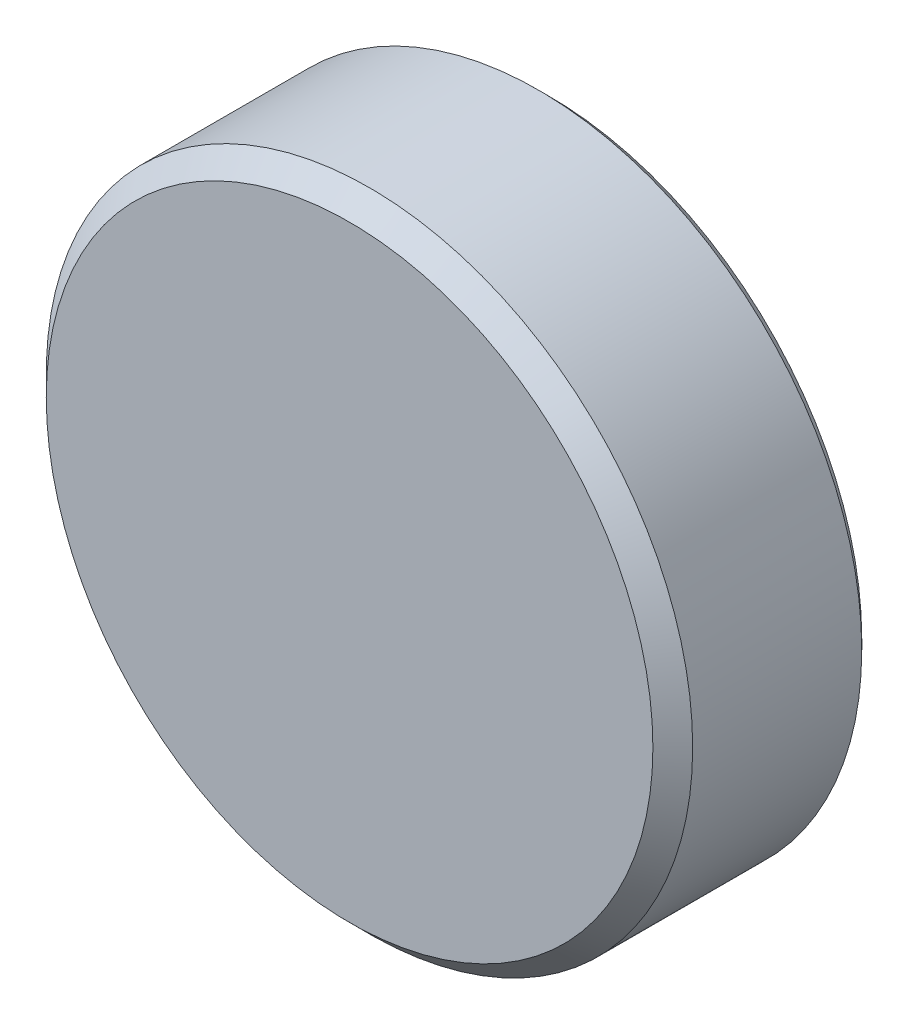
SolidWorks part; units mm, degrees
ref_plane "Front Plane" through (0, 0, 0) normal (0, 0, 1) x (1, 0, 0)
ref_plane "Top Plane" through (0, 0, 0) normal (0, 1, 0) x (1, 0, 0)
ref_plane "Right Plane" through (0, 0, 0) normal (1, 0, 0) x (0, 0, -1)
sketch "Sketch1" plane through (0, 0, 0) normal (0, 0, 1) x (1, 0, 0)
  circle A0 centre (0, 0) radius 41.275
extrude "Extrude1" add sketch "Sketch1" along normal blind 25.4
chamfer "Chamfer1" distance 2.54 angle 45 1 edges at (41.275, 0, 25.4)
chamfer "Chamfer2" distance 1.27 angle 45 1 edges at (41.275, 0, 0)
